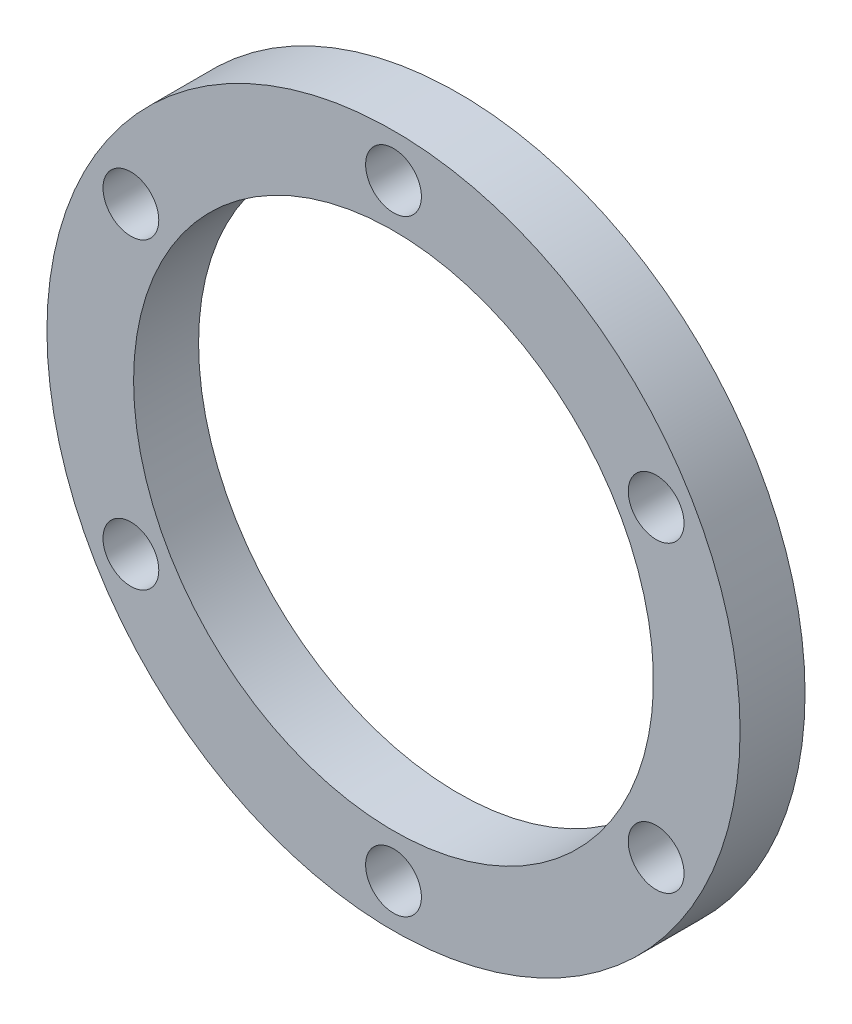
SolidWorks part; units mm, degrees
ref_plane "Front" through (0, 0, 0) normal (0, 0, 1) x (1, 0, 0)
ref_plane "Top" through (0, 0, 0) normal (0, 1, 0) x (1, 0, 0)
ref_plane "Right" through (0, 0, 0) normal (1, 0, 0) x (0, 0, -1)
sketch "Sketch1" plane through (0, 0, 0) normal (0, 0, 1) x (1, 0, 0)
  circle A0 centre (0, 0) radius 25.4
  circle A1 centre (0, 0) radius 19.05
  dimension "D1" = 50.8
  dimension "D2" = 38.1
extrude "Boss-Extrude1" add sketch "Sketch1" along normal blind 4.7625
sketch "Sketch2" plane through (0, 0, 4.7625) normal (0, 0, 1) x (1, 0, 0)
  line L0 (0, 0) -> (0, 22.225) construction
  dimension "D1" = 22.225
hole_wizard "#20 (0.161) Diameter Hole1" positions "Sketch3" profile "Sketch5" hole size "#20" standard "ANSI Inch"
sketch "Sketch3" plane through (0, 0, 4.7625) normal (0, 0, 1) x (1, 0, 0)
  point P0 (0, 22.225)
sketch "Sketch5" plane through (0, 22.225, 4.7625) normal (1, 0, 0) x (0, -1, 0)
  line L0 (0, 0) -> (0, 4.7625)
  line L1 (0, 4.7625) -> (2.0447, 4.7625)
  line L2 (2.0447, 4.7625) -> (2.0447, 0)
  line L5 (2.0447, 0) -> (0, 0)
  line L11 (0, -6.35) -> (0, 107.95) construction
  dimension "Thru Hole Dia." = 4.0894
  dimension "Thru Hole Depth" = 4.7625
pattern_circular "CirPattern1" count 6 over 360 about axis through (0, 0, 0) along (0, 0, 1) of "#20 (0.161) Diameter Hole1"
